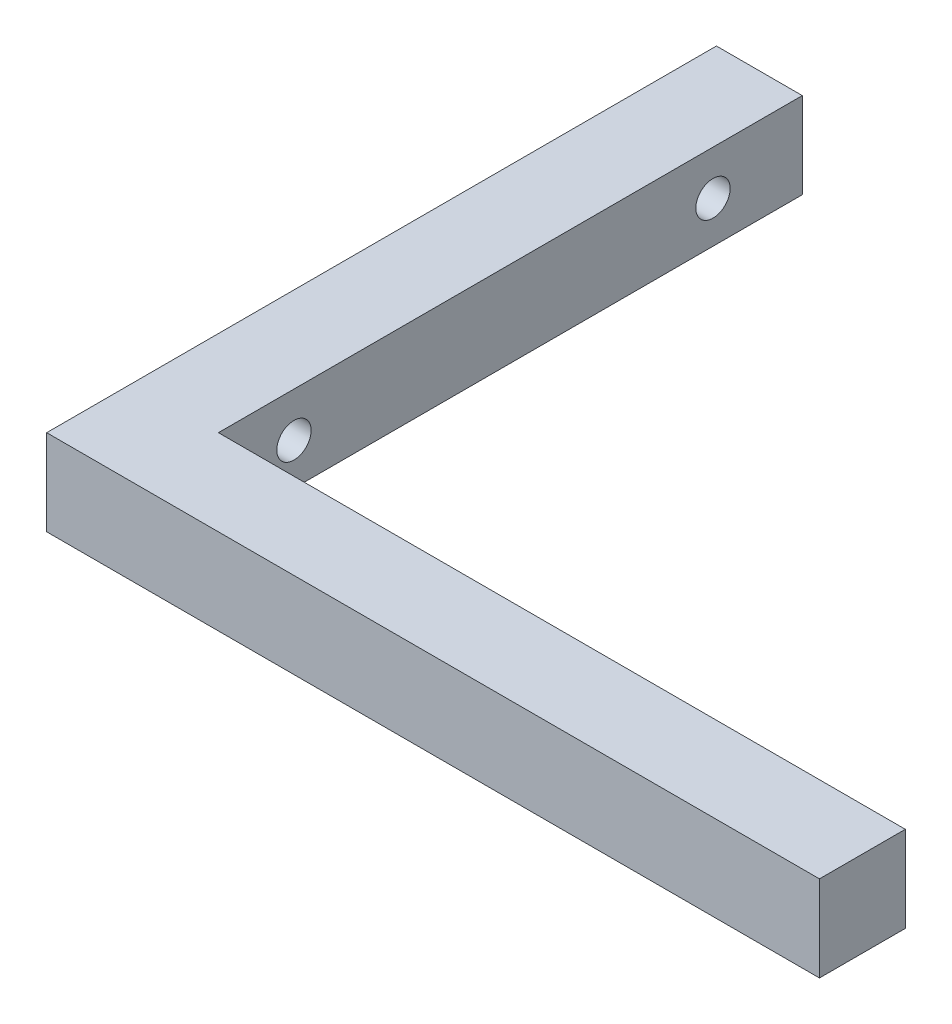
SolidWorks part; units mm, degrees
ref_plane "Front Plane" through (0, 0, 0) normal (0, 0, 1) x (1, 0, 0)
ref_plane "Top Plane" through (0, 0, 0) normal (0, 1, 0) x (1, 0, 0)
ref_plane "Right Plane" through (0, 0, 0) normal (1, 0, 0) x (0, 0, -1)
sketch "Sketch1" plane through (0, 0, 0) normal (0, 1, 0) x (1, 0, 0)
  line L0 (0, 0) -> (-57.15, 0)
  line L1 (-57.15, 0) -> (-57.15, 49.53)
  line L2 (-57.15, 49.53) -> (-50.8, 49.53)
  line L3 (-50.8, 49.53) -> (-50.8, 6.35)
  line L4 (-50.8, 6.35) -> (0, 6.35)
  line L5 (0, 6.35) -> (0, 0)
  dimension "D1" = 6.35
  dimension "D2" = 43.18
  dimension "D3" = 50.8
extrude "Boss-Extrude1" add sketch "Sketch1" along normal blind 6.35
sketch "Sketch3" plane through (-57.15, 0, 0) normal (-1, 0, 0) x (0, 0, 1)
  line L0 (-6.35, 6.35) -> (-6.35, 0)
  line L1 (-49.53, 6.35) -> (0, 6.35) construction
  line L2 (-49.53, 0) -> (0, 0) construction
  line L3 (0, 6.35) -> (0, 0) construction
  circle A0 centre (-42.926, 3.0727) radius 1.27
  circle A1 centre (-11.938, 3.0727) radius 1.27
  dimension "D2" = 2.54
  dimension "D1" = 6.35
  dimension "D3" = 5.588
  dimension "D4" = 30.988
extrude "Cut-Extrude2" cut sketch "Sketch3" against normal blind 6.35 contours A0 | A1
